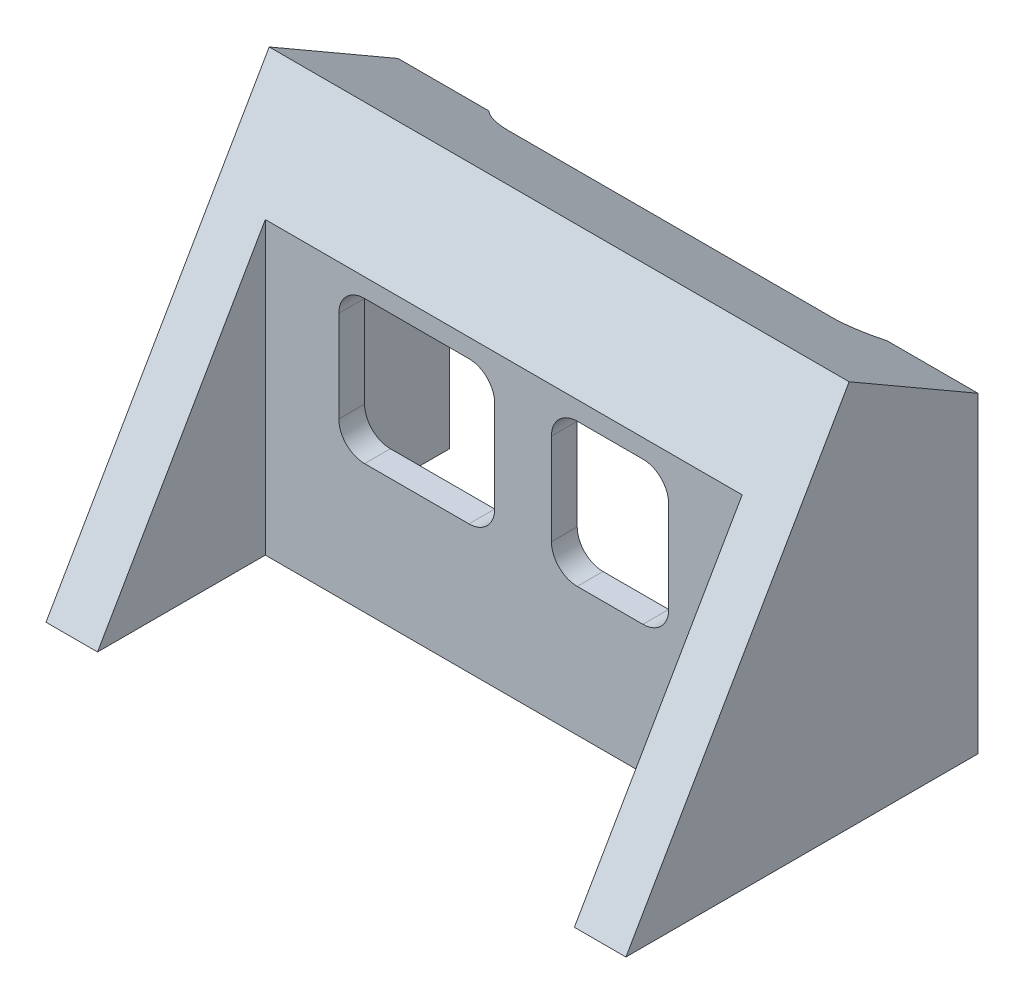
SolidWorks part; units mm, degrees
ref_plane "Front Plane" through (0, 0, 0) normal (0, 0, 1) x (1, 0, 0)
ref_plane "Top Plane" through (0, 0, 0) normal (0, 1, 0) x (1, 0, 0)
ref_plane "Right Plane" through (0, 0, 0) normal (1, 0, 0) x (0, 0, -1)
sketch "Sketch1" plane through (0, 0, 0) normal (1, 0, 0) x (0, 0, -1)
  line L0 (0, 0) -> (17.3205, 30)
  line L1 (17.3205, 30) -> (27.3205, 30)
  line L2 (27.3205, 30) -> (27.3205, 0)
  line L3 (27.3205, 0) -> (0, 0)
  dimension "D1" = 60
  dimension "D2" = 30
  dimension "D3" = 10
extrude "Boss-Extrude1" add sketch "Sketch1" along normal mid plane 45
sketch "Sketch2" plane through (0, 0, 0) normal (0, 1, 0) x (1, 0, 0)
  line L0 (-18.5, 0) -> (-18.5, 13.02)
  line L1 (22.5, 0) -> (-22.5, 0) construction
  line L2 (-18.5, 13.02) -> (18.5, 13.02)
  line L3 (18.5, 13.02) -> (18.5, 0)
  line L4 (-22.5, 0) -> (-22.5, 27.3205) construction
  line L5 (22.5, 0) -> (22.5, 27.3205) construction
  dimension "D1" = 4
  dimension "D2" = 4
  dimension "D3" = 13.02
extrude "Cut-Extrude1" cut sketch "Sketch2" against normal through all and the other way through all flip side to cut
sketch "Sketch3" plane through (0, 0, 0) normal (0, 1, 0) x (1, 0, 0)
  line L0 (-18.5, 27.3205) -> (-18.5, 15.02)
  line L1 (22.5, 27.3205) -> (-22.5, 27.3205) construction
  line L2 (-18.5, 15.02) -> (18.5, 15.02)
  line L3 (18.5, 15.02) -> (18.5, 27.3205)
  line L4 (18.5, 27.3205) -> (-18.5, 27.3205)
  line L5 (18.5, 0) -> (18.5, 13.02) construction
  line L6 (-18.5, 13.02) -> (-18.5, 0) construction
  line L8 (18.5, 13.02) -> (-18.5, 13.02) construction
  dimension "D1" = 2
extrude "Cut-Extrude4" cut sketch "Sketch3" along normal blind 25
sketch "Sketch4" plane through (0, 0, -13.02) normal (0, 0, 1) x (1, 0, 0)
  line L0 (18.5, 0) -> (-18.5, 0) construction
  line L1 (-12.8, 10) -> (-0.7, 10)
  line L2 (-12.8, 10) -> (-12.8, 21.1)
  line L3 (-12.8, 21.1) -> (-0.7, 21.1)
  line L4 (-0.7, 10) -> (-0.7, 21.1)
  line L5 (3.7, 10) -> (12.8, 10)
  line L6 (3.7, 10) -> (3.7, 21.1)
  line L7 (3.7, 21.1) -> (12.8, 21.1)
  line L8 (12.8, 10) -> (12.8, 21.1)
  line L9 (-12.8, 10) -> (-18.5, 10) construction
  line L10 (-18.5, 0) -> (-18.5, 22.5513) construction
  line L11 (12.8, 10) -> (18.5, 10) construction
  line L12 (18.5, 22.5513) -> (18.5, 0) construction
  dimension "D1" = 12.1
  dimension "D2" = 9.1
  dimension "D3" = 11.1
  dimension "D4" = 11.1
  dimension "D5" = 10
  dimension "D6" = 4.4
extrude "Cut-Extrude5" cut sketch "Sketch4" against normal through all
hole_wizard "M3x0.5 Tapped Hole1" positions "Sketch6" profile "Sketch5" tap size "M3x0.5" standard "ANSI Metric"
sketch "Sketch6" plane through (0, 0, 0) normal (0, -1, 0) x (-1, 0, 0)
  line L0 (20.5, 7.3205) -> (-20.5, 7.3205) construction
  line L1 (-20.5, 7.3205) -> (-20.5, 22.3205) construction
  line L2 (-20.5, 22.3205) -> (20.5, 22.3205) construction
  line L3 (20.5, 22.3205) -> (20.5, 7.3205) construction
  line L4 (20.5, 7.3205) -> (22.5, 7.3205) construction
  line L5 (22.5, 0) -> (22.5, 27.3205) construction
  line L7 (-20.5, 7.3205) -> (-22.5, 7.3205) construction
  line L8 (-22.5, 0) -> (-22.5, 27.3205) construction
  line L11 (-22.5, 27.3205) -> (-18.5, 27.3205) construction
  point P0 (20.5, 7.3205)
  point P2 (20.5, 22.3205)
  point P4 (-20.5, 7.3205)
  point P6 (-20.5, 22.3205)
  dimension "D1" = 2
  dimension "D2" = 15
  dimension "D3" = 5
sketch "Sketch5" plane through (-20.5, 0, -7.3205) normal (1, 0, 0) x (0, 0, -1)
  line L0 (0, 0) -> (0, 9.2511)
  line L1 (0, 9.2511) -> (1.25, 8.5)
  line L2 (1.25, 8.5) -> (1.25, 0)
  line L5 (1.25, 0) -> (0, 0)
  line L10 (0, 9.2511) -> (-1.25, 8.5) construction
  line L11 (0, -6.35) -> (0, 107.95) construction
  dimension "Tap Drill Dia." = 2.5
  dimension "Tap Drill Depth" = 8.5
  dimension "Drill Angle" = 118
sketch "Sketch7" plane through (22.5, 0, 0) normal (1, 0, 0) x (0, 0, -1)
  line L0 (17.3205, 30) -> (27.3205, 24.2265)
  line L1 (27.3205, 0) -> (27.3205, 30) construction
  line L2 (27.3205, 24.2265) -> (27.3205, 30)
  line L3 (27.3205, 30) -> (17.3205, 30)
  line L4 (17.3205, 30) -> (0, 0) construction
  dimension "D1" = 90
extrude "Cut-Extrude6" cut sketch "Sketch7" against normal through all
fillet "Fillet1" radius 2 8 edges at (3.7, 21.1, -14.02) (12.8, 10, -14.02) (3.7, 10, -14.02) (12.8, 21.1, -14.02) (-0.7, 21.1, -14.02) (-0.7, 10, -14.02) (-12.8, 10, -14.02) (-12.8, 21.1, -14.02)
fillet "Fillet2" radius 6 2 edges at (-18.5, 25, -20.5004) (18.5, 25, -20.5004)
